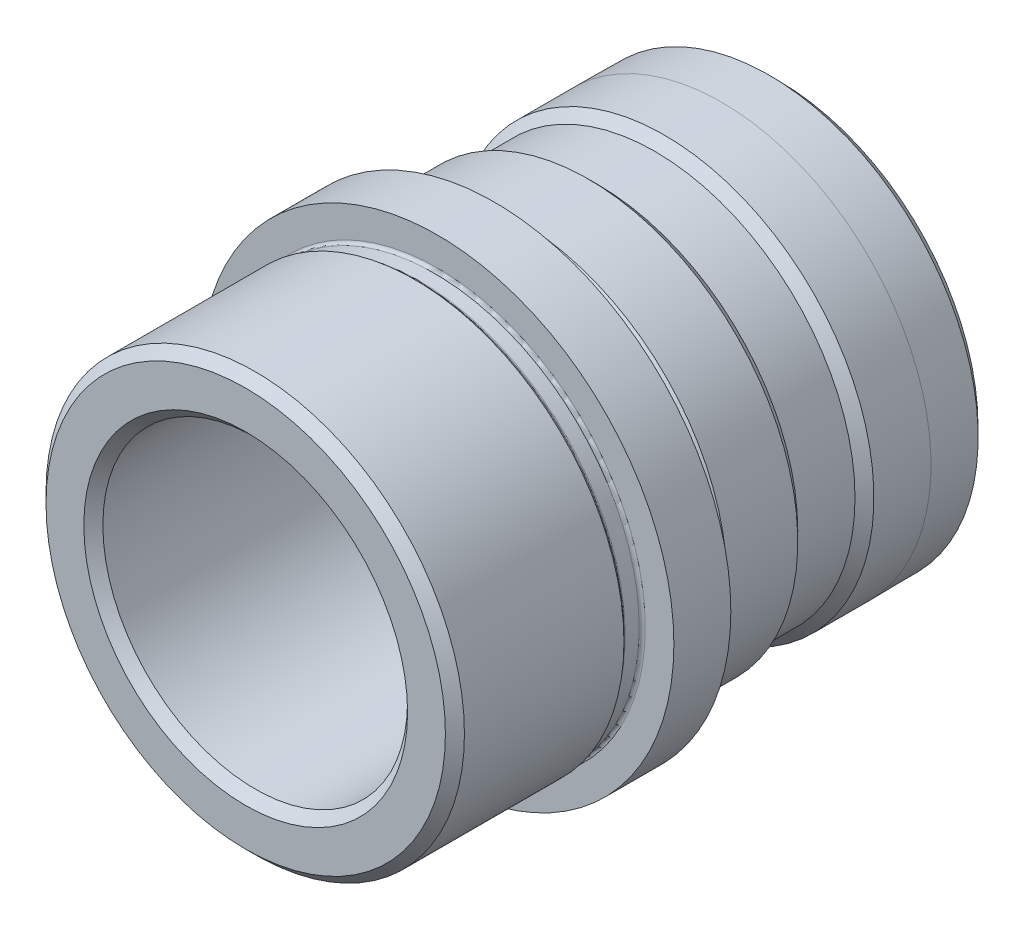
SolidWorks part; units mm, degrees
ref_plane "Front Plane" through (0, 0, 0) normal (0, 0, 1) x (1, 0, 0)
ref_plane "Top Plane" through (0, 0, 0) normal (0, 1, 0) x (1, 0, 0)
ref_plane "Right Plane" through (0, 0, 0) normal (1, 0, 0) x (0, 0, -1)
sketch "Sketch1" plane through (0, 0, 0) normal (1, 0, 0) x (0, 0, -1)
  line L0 (0, 0) -> (0, 13.8025) construction
  line L1 (0, 0) -> (-10.6147, 0) construction
  line L2 (-16.002, 12.7076) -> (28.448, 12.7076)
  line L3 (-16.002, 12.7076) -> (-16.002, 17.4498)
  line L4 (-16.002, 17.4498) -> (-1.905, 17.4498)
  line L5 (28.448, 17.4273) -> (28.448, 12.7076)
  line L6 (0, 19.7104) -> (0, 17.0688)
  line L7 (0, 19.7104) -> (4.7498, 19.7104)
  line L8 (4.7498, 19.7104) -> (4.7498, 17.0688)
  line L9 (13.3604, 16.6814) -> (18.1356, 16.6814)
  line L10 (18.923, 17.4688) -> (23.6855, 17.4688)
  line L11 (13.3604, 16.6814) -> (12.573, 17.4688)
  line L12 (18.1356, 16.6814) -> (18.923, 17.4688)
  line L13 (15.748, 16.6814) -> (15.748, 10.5708) construction
  line L14 (-1.524, 17.0688) -> (0, 17.0688)
  line L15 (6.6738, 17.4688) -> (12.573, 17.4688)
  line L16 (23.6855, 17.4688) -> (28.448, 17.4273)
  line L17 (-1.524, 17.0688) -> (-1.905, 17.4498)
  line L18 (6.2738, 17.0688) -> (6.6738, 17.4688)
  line L19 (4.7498, 17.0688) -> (6.2738, 17.0688)
  dimension "D8" = 6.35
  dimension "D1" = 34.8996
  dimension "D2" = 25.4152
  dimension "D3" = 39.4208
  dimension "D4" = 4.7498
  dimension "D5" = 28.448
  dimension "D6" = 44.45
  dimension "D7" = 0.7874
  dimension "D9" = 45
  dimension "D10" = 4.7625
  dimension "D11" = 34.9377
  dimension "D12" = 0.5
  dimension "D13" = 15.748
  dimension "D14" = 0.381
  dimension "D15" = 1.524
  dimension "D16" = 1.524
  dimension "D17" = 45
  dimension "D18" = 45
revolve "Revolve1" add sketch "Sketch1" angle 360 about L1
sketch "Sketch2" plane through (0, 0, 0) normal (0, 1, 0) x (1, 0, 0)
  line L0 (-19.7104, 0) -> (19.7104, 0) construction
  circle A0 centre (0, 15.748) radius 2.3749
  dimension "D1" = 4.7498
  dimension "D2" = 15.748
extrude "Cut-Extrude1" cut sketch "Sketch2" against normal through all
fillet "Fillet1" radius 3.048 1 edges at (-12.7076, 0, -28.448)
chamfer "Chamfer1" distance 0.7937 angle 45 3 edges at (-17.4273, 0, -28.448) (-17.4498, 0, 16.002) (-12.7076, 0, 16.002)
fillet "Fillet2" radius 0.254 4 edges at (-17.0688, 0, -6.2738) (-17.0688, 0, -4.7498) (-17.0688, 0, 1.524) (-17.0688, 0, 0)
